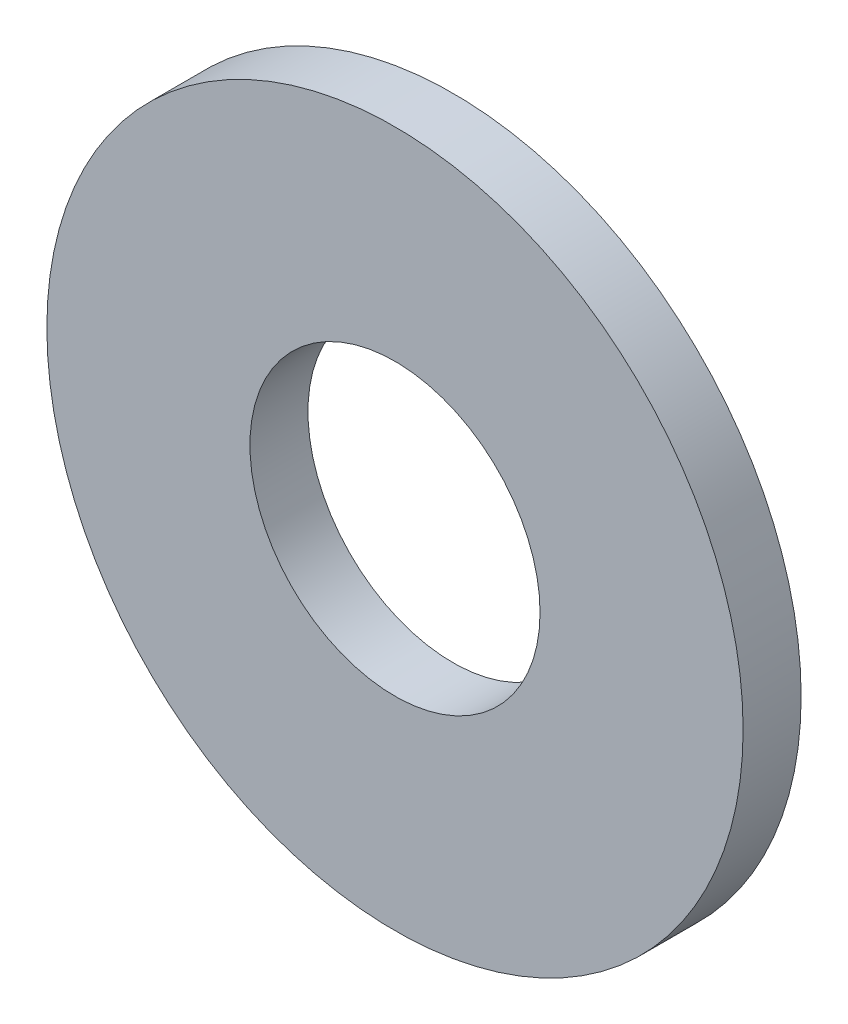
SolidWorks part; units mm, degrees
ref_plane "Plane1" through (0, 0, 0) normal (0, 0, 1) x (1, 0, 0)
ref_plane "Plane2" through (0, 0, 0) normal (0, 1, 0) x (1, 0, 0)
ref_plane "Plane3" through (0, 0, 0) normal (1, 0, 0) x (0, 0, -1)
sketch "Sketch1" plane through (0, 0, 0) normal (0, 0, 1) x (1, 0, 0)
  circle A0 centre (0, 0) radius 9.525
  circle A1 centre (0, 0) radius 3.9688
  dimension "O.D." = 19.05
  dimension "I.D." = 7.9375
extrude "Washer" add sketch "Sketch1" along normal blind 1.5875
